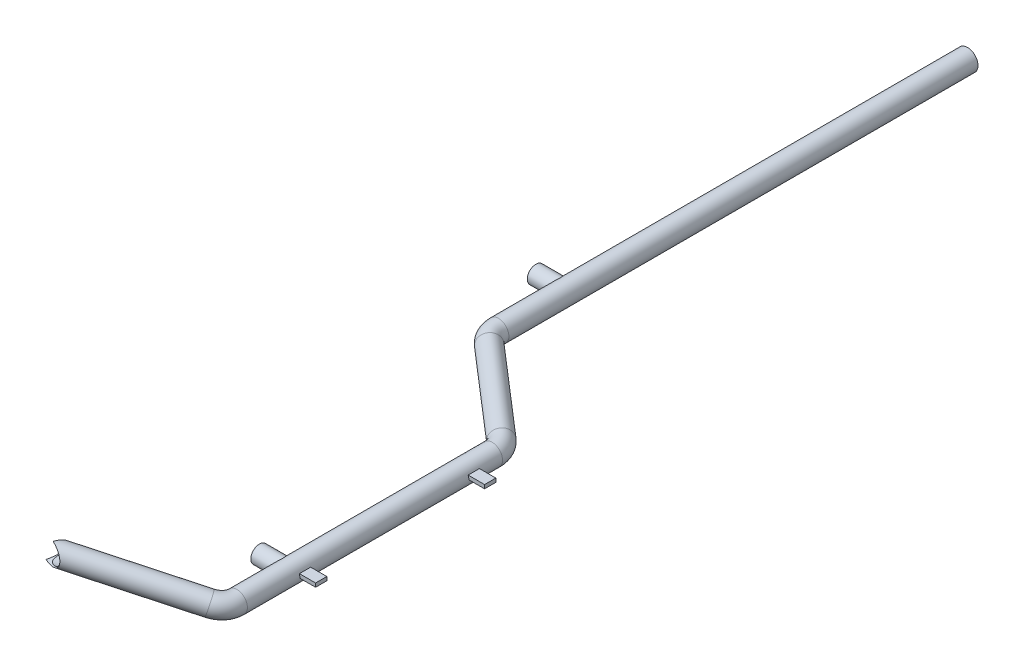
SolidWorks part; units mm, degrees
ref_plane "Plan1" through (0, 0, 0) normal (0, 0, 1) x (1, 0, 0)
ref_plane "Plan2" through (0, 0, 0) normal (0, 1, 0) x (1, 0, 0)
ref_plane "Plan3" through (0, 0, 0) normal (1, 0, 0) x (0, 0, -1)
ref_plane "Plan4" through (-146, 0, 0) normal (1, 0, 0) x (0, 0, -1)
ref_plane "Plan5" through (-285, 0, 0) normal (1, 0, 0) x (0, 0, -1)
sketch3d "3DSketch3"
  line L0 (-280.4925, 49.7426, 0) -> (-224.698, 29.1068, -41.4852) construction
  line L1 (-158.0424, 4.4539, -91.0461) -> (-242.0268, 35.5159, -28.6006)
  line L2 (-146, 0, -115.6534) -> (-146, 0, -456.2663)
  line L3 (-156.3957, 0, -478.9747) -> (-274.6043, 0, -581.0253)
  line L4 (-285, 0, -603.7337) -> (-285, 0, -1230)
  arc A0 (-146, 0, -115.6534) -> (-158.0424, 4.4539, -91.0461) centre (-174.1372, 10.4067, -115.6534) ccw
  arc A1 (-156.3957, 0, -478.9747) -> (-146, 0, -456.2663) centre (-176, 0, -456.2663) ccw
  arc A2 (-285, 0, -603.7337) -> (-274.6043, 0, -581.0253) centre (-255, 0, -603.7337) ccw
  point P0 (-280.4925, 49.7426, 0)
  point P14 (-146, 0, -100)
  point P16 (-184.5439, -17.7305, -115.6534)
  point P19 (-146, 0, -470)
  point P20 (-176, -30, -456.2663)
  point P23 (-285, 0, -590)
  point P24 (-255, 30, -603.7337)
  dimension "D1" = 30
  dimension "D2" = 30
  dimension "D3" = 30
sketch "Esquisse3" plane through (0, 0, -1230) normal (0, 0, 1) x (1, 0, 0)
  circle A0 centre (-285, 0) radius 14
  circle A1 centre (285, 0) radius 14 construction
sweep "Base-Balayage" add profiles "Esquisse3" path "3DSketch3"
sketch "Esquisse4" plane through (0, 0, -1230) normal (0, 0, 1) x (1, 0, 0)
  circle A0 centre (-285, 0) radius 12.5
  circle A1 centre (285, 0) radius 12.5 construction
sketch3d "3DSketch4"
  line L0 (-280.4925, 49.7426, 0) -> (-224.698, 29.1068, -41.4852) construction
  line L1 (-158.0424, 4.4539, -91.0461) -> (-242.0268, 35.5159, -28.6006)
  line L2 (-146, 0, -115.6534) -> (-146, 0, -456.2663)
  line L3 (-156.3957, 0, -478.9747) -> (-274.6043, 0, -581.0253)
  line L4 (-285, 0, -603.7337) -> (-285, 0, -1230)
  line L5 (-158.0424, 4.4539, -91.0461) -> (-242.0268, 35.5159, -28.6006) construction
  line L7 (-146, 0, -115.6534) -> (-146, 0, -456.2663) construction
  line L8 (-156.3957, 0, -478.9747) -> (-274.6043, 0, -581.0253) construction
  line L9 (-285, 0, -603.7337) -> (-285, 0, -1230) construction
  arc A0 (-146, 0, -115.6534) -> (-158.0424, 4.4539, -91.0461) centre (-174.1372, 10.4067, -115.6534) ccw
  arc A1 (-156.3957, 0, -478.9747) -> (-146, 0, -456.2663) centre (-176, 0, -456.2663) ccw
  arc A2 (-285, 0, -603.7337) -> (-274.6043, 0, -581.0253) centre (-255, 0, -603.7337) ccw
  point P14 (-146, 0, -100)
  point P16 (-184.5439, -17.7305, -115.6534)
  point P19 (-146, 0, -470)
  point P20 (-176, -30, -456.2663)
  point P23 (-285, 0, -590)
  point P24 (-255, 30, -603.7337)
  dimension "D1" = 30
  dimension "D2" = 30
  dimension "D3" = 30
sweep "Enlèvement de matière-Balayage1" cut profiles "Esquisse4" path "3DSketch4"
sketch "Esquisse5" plane through (-138.4302, 51.199, 102.9279) normal (-0.7693, 0.2845, 0.572) x (0.5365, -0.1984, 0.8202)
  circle A0 centre (-160.3526, -50.6458) radius 12.5 construction
  circle A1 centre (-160.3526, -50.6458) radius 14
  circle A2 centre (-160.3526, -50.6458) radius 14
  circle A3 centre (-160.3526, -50.6458) radius 12.5
  dimension "D1" = 0
extrude "Boss.-Extru.1" add sketch "Esquisse5" along normal up to surface (37.4739 mm away)
sketch "Esquisse6" plane through (-146, 0, 0) normal (1, 0, 0) x (0, 0, -1)
  line L0 (456.2663, 0) -> (115.6534, 0) construction
  line L1 (115.6534, 14) -> (115.6534, -14) construction
  circle A0 centre (185.6534, 0) radius 10
  circle A1 centre (185.6534, 0) radius 11.5
  dimension "D1" = 20
  dimension "D2" = 23
  dimension "D3" = 70
extrude "Boss.-Extru.2" add sketch "Esquisse6" against normal blind 40
sketch "Esquisse7" plane through (-285, 0, 0) normal (1, 0, 0) x (0, 0, -1)
  line L0 (456.2663, 0) -> (115.6534, 0) construction
  line L1 (603.7337, 14) -> (603.7337, -14) construction
  circle A0 centre (693.7337, 0) radius 10
  circle A1 centre (693.7337, 0) radius 11.5
  dimension "D1" = 23
  dimension "D2" = 20
  dimension "D3" = 90
extrude "Boss.-Extru.3" add sketch "Esquisse7" against normal blind 40
sketch "Esquisse8" plane through (-146, 0, 0) normal (1, 0, 0) x (0, 0, -1)
  line L0 (115.6534, 14) -> (115.6534, -14) construction
  line L1 (185.6534, 4) -> (200.6534, 4)
  line L2 (185.6534, 4) -> (185.6534, -1)
  line L3 (185.6534, -1) -> (200.6534, -1)
  line L4 (200.6534, 4) -> (200.6534, -1)
  line L5 (456.2663, 14) -> (115.6534, 14) construction
  line L6 (456.2663, 0) -> (115.6534, 0) construction
  line L7 (411.2663, 5) -> (426.2663, 5)
  line L8 (411.2663, 5) -> (411.2663, 0)
  line L9 (411.2663, 0) -> (426.2663, 0)
  line L10 (426.2663, 5) -> (426.2663, 0)
  line L11 (456.2663, 14) -> (456.2663, -14) construction
  dimension "D1" = 5
  dimension "D2" = 15
  dimension "D3" = 70
  dimension "D4" = 10
  dimension "D5" = 15
  dimension "D6" = 5
  dimension "D7" = 30
extrude "Boss.-Extru.4" add sketch "Esquisse8" along normal blind 35
